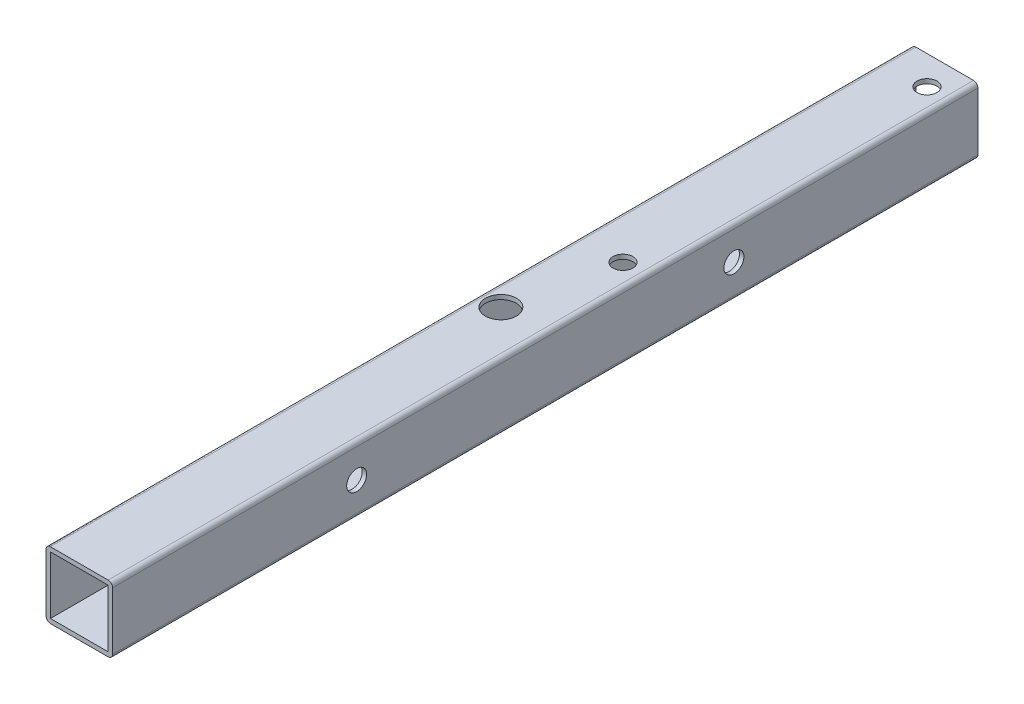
SolidWorks part; units mm, degrees
ref_plane "Plan1" through (0, 0, 0) normal (0, 0, 1) x (1, 0, 0)
ref_plane "Plan2" through (0, 0, 0) normal (0, 1, 0) x (1, 0, 0)
ref_plane "Plan3" through (0, 0, 0) normal (1, 0, 0) x (0, 0, -1)
sketch "Esquisse1" plane through (0, 0, 0) normal (0, 0, 1) x (1, 0, 0)
  line L0 (-13, 15) -> (13, 15)
  line L1 (-15, 13) -> (-15, -13)
  line L2 (13, -15) -> (-13, -15)
  line L3 (15, -13) -> (15, 13)
  line L4 (13, 13) -> (-13, -13) construction
  arc A0 (-13, -15) -> (-15, -13) centre (-13, -13) cw
  arc A1 (-15, 13) -> (-13, 15) centre (-13, 13) cw
  arc A2 (15, 13) -> (13, 15) centre (13, 13) ccw
  arc A3 (15, -13) -> (13, -15) centre (13, -13) cw
  dimension "D1" = 2
  dimension "D2" = 30
extrude "Base-Extru.-Mince" add sketch "Esquisse1" along normal blind 390 thin
sketch "Esquisse2" plane through (0, 15, 0) normal (0, 1, 0) x (-1, 0, 0)
  line L1 (15, 390) -> (15, 0) construction
  line L2 (13, 0) -> (-13, 0) construction
  circle A0 centre (-5, 13) radius 4.5
  circle A1 centre (-5, 150) radius 4.5
  circle A2 centre (5, 195) radius 7
  dimension "D3" = 9
  dimension "D4" = 20
  dimension "D2" = 137
  dimension "D5" = 10
  dimension "D7" = 14
  dimension "D1" = 13
  dimension "D6" = 195
extrude "Enlèv. mat.-Extru.1" cut sketch "Esquisse2" against normal through all
sketch "Esquisse3" plane through (-15, 0, 0) normal (-1, 0, 0) x (0, 0, 1)
  line L1 (0, 13) -> (0, -13) construction
  circle A1 centre (110, 0) radius 4.5
  circle A2 centre (280, 0) radius 4.5
  dimension "D7" = 9
  dimension "D1" = 110
  dimension "D3" = 170
extrude "Enlèv. mat.-Extru.2" cut sketch "Esquisse3" against normal through all
sketch "Esquisse4" plane through (0, -15, 0) normal (0, -1, 0) x (1, 0, 0)
  circle A1 centre (5, 150) radius 7
  circle A2 centre (5, 13) radius 7
  dimension "D1" = 14
extrude "Enlèv. mat.-Extru.3" cut sketch "Esquisse4" against normal blind 10
